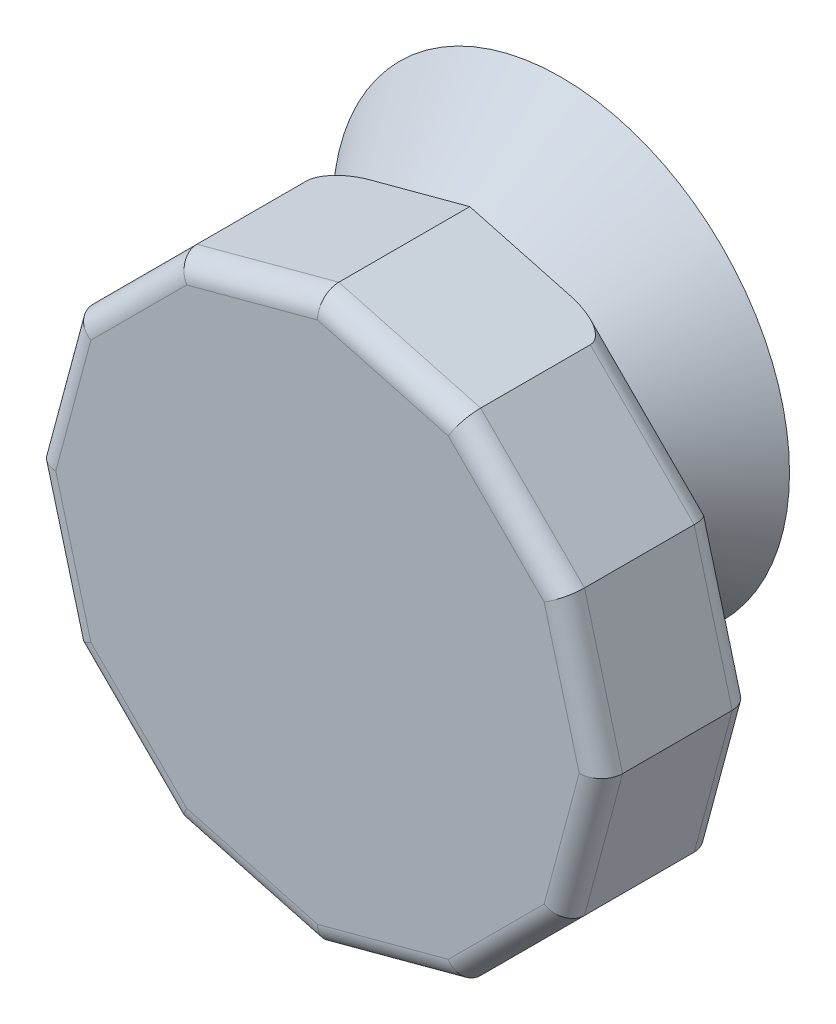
SolidWorks part; units mm, degrees
ref_plane "Plan de face" through (0, 0, 0) normal (0, 0, 1) x (1, 0, 0)
ref_plane "Plan de dessus" through (0, 0, 0) normal (0, 1, 0) x (1, 0, 0)
ref_plane "Plan de droite" through (0, 0, 0) normal (1, 0, 0) x (0, 0, -1)
sketch "Esquisse1" plane through (0, 0, 0) normal (0, 0, 1) x (1, 0, 0)
  line L0 (-8.0692, 4.6587) -> (-9.3175, 0)
  line L1 (8.0692, -4.6587) -> (9.3175, 0)
  line L2 (9.3175, 0) -> (8.0692, 4.6587)
  line L3 (8.0692, 4.6587) -> (4.6587, 8.0692)
  line L4 (4.6587, 8.0692) -> (0, 9.3175)
  line L5 (0, 9.3175) -> (-4.6587, 8.0692)
  line L6 (-4.6587, 8.0692) -> (-8.0692, 4.6587)
  line L7 (-9.3175, 0) -> (-8.0692, -4.6587)
  line L8 (-8.0692, -4.6587) -> (-4.6587, -8.0692)
  line L9 (-4.6587, -8.0692) -> (0, -9.3175)
  line L10 (0, -9.3175) -> (4.6587, -8.0692)
  line L11 (4.6587, -8.0692) -> (8.0692, -4.6587)
  circle A1 centre (0, 0) radius 9 construction
  dimension "D1" = 18
extrude "Boss.-Extru.1" add sketch "Esquisse1" along normal blind 5
sketch "Esquisse5" plane through (0, 0, 0) normal (1, 0, 0) x (0, 0, -1)
  line L0 (0, 4) -> (3, 4)
  line L1 (0, 8.0692) -> (0, 4.6587) construction
  line L2 (3, 4) -> (3, 11.5)
  line L3 (3, 11.5) -> (0, 9)
  line L4 (0, 9) -> (0, -9) construction
  line L5 (0, 9) -> (0, 4)
  line L7 (2.6635, 4) -> (-3.6802, 4) construction
  dimension "D1" = 3
  dimension "D2" = 5
  dimension "7.5" = 7.5
  dimension "D3" = 4
revolve "Révolution1" add sketch "Esquisse5" angle 360 about L7
sketch "Esquisse7" plane through (0, 0, -3) normal (0, 0, -1) x (-1, 0, 0)
  line L1 (-5, 3) -> (5, 3)
  line L2 (-5, 3) -> (-5, 1)
  line L3 (-5, 1) -> (5, 1)
  line L4 (5, 3) -> (5, 1)
  dimension "D1" = 1
  dimension "D2" = 2
  dimension "D3" = 5
  dimension "D4" = 10
extrude "Enlèv. mat.-Extru.9" cut sketch "Esquisse7" against normal blind 4 draft 10
fillet "Congé1" radius 0.7 22 edges at (-8.6933, 2.3294, 5) (-6.364, 6.364, 5) (-2.3294, 8.6933, 5) (2.3294, 8.6933, 5) (6.364, 6.364, 5) (8.6933, 2.3294, 5) (8.6933, -2.3294, 5) (6.364, -6.364, 5) (2.3294, -8.6933, 5) (-2.3294, -8.6933, 5) (-6.364, -6.364, 5) (-8.6933, -2.3294, 5) (-6.364, 6.364, 0) (-8.6933, 2.3294, 0) (-8.6933, -2.3294, 0) (-6.364, -6.364, 0) (-2.3294, -8.6933, 0) (2.3294, -8.6933, 0) (6.364, -6.364, 0) (8.6933, -2.3294, 0) (8.6933, 2.3294, 0) (6.364, 6.364, 0)
